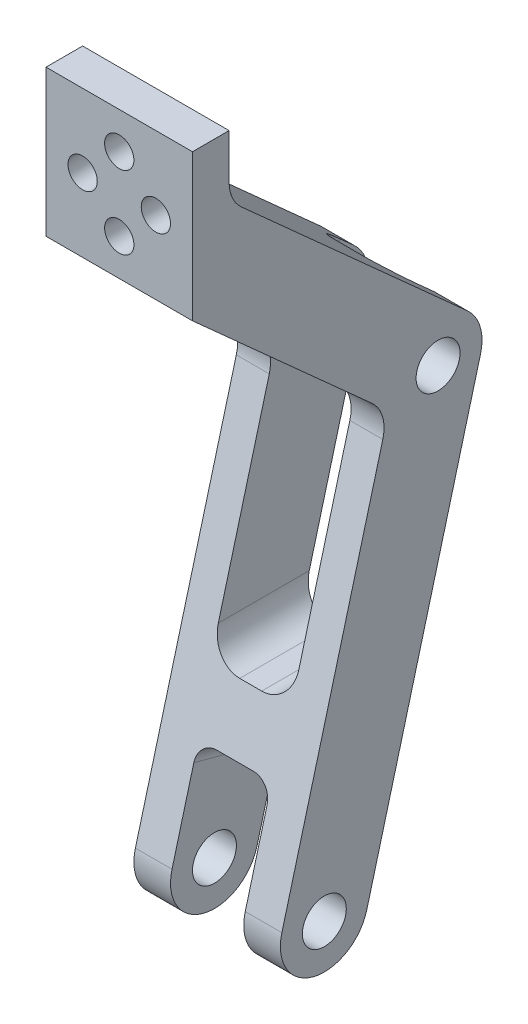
SolidWorks part; units mm, degrees
ref_plane "Front Plane" through (0, 0, 0) normal (0, 0, 1) x (1, 0, 0)
ref_plane "Top Plane" through (0, 0, 0) normal (0, 1, 0) x (1, 0, 0)
ref_plane "Right Plane" through (0, 0, 0) normal (1, 0, 0) x (0, 0, -1)
sketch "Sketch1" plane through (0, 0, 0) normal (1, 0, 0) x (0, 0, -1)
  line L0 (-195.4369, 0) -> (9576.4093, 0) construction
  line L1 (0, -195.4369) -> (0, 9576.4093) construction
  line L2 (0, 0) -> (15.5291, 57.9555) construction
  line L3 (5.7956, -1.5529) -> (21.3247, 56.4026)
  line L4 (-5.7956, 1.5529) -> (8.7805, 55.9516)
  line L5 (-13, 91.6382) -> (-13, 100)
  line L6 (-13, 100) -> (-18, 100)
  line L7 (-18, 100) -> (-18, 80)
  line L8 (-18, 80) -> (8.7805, 55.9516)
  line L9 (19.5379, 62.4198) -> (-13, 91.6382)
  circle A0 centre (0, 0) radius 3
  arc A1 (-5.7956, 1.5529) -> (5.7956, -1.5529) centre (0, 0) ccw
  circle A2 centre (15.5291, 57.9555) radius 3
  arc A3 (21.3247, 56.4026) -> (19.5379, 62.4198) centre (15.5291, 57.9555) ccw
  dimension "D1" = 6
  dimension "D2" = 12
  dimension "D3" = 75
  dimension "D4" = 60
  dimension "D5" = 5
  dimension "D6" = 20
  dimension "D7" = 100
  dimension "D8" = 18
  dimension "D9" = 12
extrude "Boss-Extrude1" add sketch "Sketch1" along normal mid plane 20
fillet "Fillet1" radius 5 2 edges at (0, 55.9516, -8.7805) (0, 91.6382, 13)
sketch "Sketch2" plane through (0, -1.5529, -5.7956) normal (0, -0.2588, -0.9659) x (-1, 0, 0)
  line L0 (-10, -6) -> (10, -6) construction
  line L1 (5, -6) -> (-5, -6)
  line L2 (5, -6) -> (5, 11.5)
  line L3 (2.5, 14) -> (-2.5, 14)
  line L4 (-5, -6) -> (-5, 11.5)
  arc A0 (5, 11.5) -> (2.5, 14) centre (2.5, 11.5) ccw
  arc A1 (-2.5, 14) -> (-5, 11.5) centre (-2.5, 11.5) ccw
  point P0 (0, -6)
  point P10 (0, -6)
  point P11 (5, 14)
  point P14 (-5, 14)
  dimension "D3" = 2.5
  dimension "D1" = 10
  dimension "D2" = 20
extrude "Cut-Extrude1" cut sketch "Sketch2" against normal blind 20
sketch "Sketch3" plane through (0, 0, 18) normal (0, 0, 1) x (1, 0, 0)
  line L0 (0, -1000) -> (0, 49000) construction
  line L1 (-5, 90) -> (5, 90) construction
  line L2 (10, 100) -> (-10, 100) construction
  line L3 (10, 80) -> (-10, 80) construction
  line L4 (5.5, 23) -> (-5.5, 23)
  line L5 (5.5, 23) -> (5.5, 68)
  line L6 (5.5, 68) -> (-5.5, 68)
  line L7 (-5.5, 23) -> (-5.5, 68)
  line L8 (5.5, 23) -> (-5.5, 68) construction
  line L9 (5.5, 68) -> (-5.5, 23) construction
  circle A0 centre (0, 95) radius 2
  circle A1 centre (-5, 90) radius 2
  circle A2 centre (0, 85) radius 2
  circle A3 centre (5, 90) radius 2
  point P13 (0, 45.5)
  dimension "D1" = 4
  dimension "D2" = 10
  dimension "D3" = 10
  dimension "D4" = 5
  dimension "D5" = 11
  dimension "D6" = 45
  dimension "D7" = 12
extrude "Cut-Extrude2" cut sketch "Sketch3" against normal through all both and the other way through all
fillet "Fillet2" radius 4 4 edges at (5.5, 68, -4.3435) (-5.5, 68, -4.3435) (5.5, 23, -6.1628) (-5.5, 23, -6.1628)
